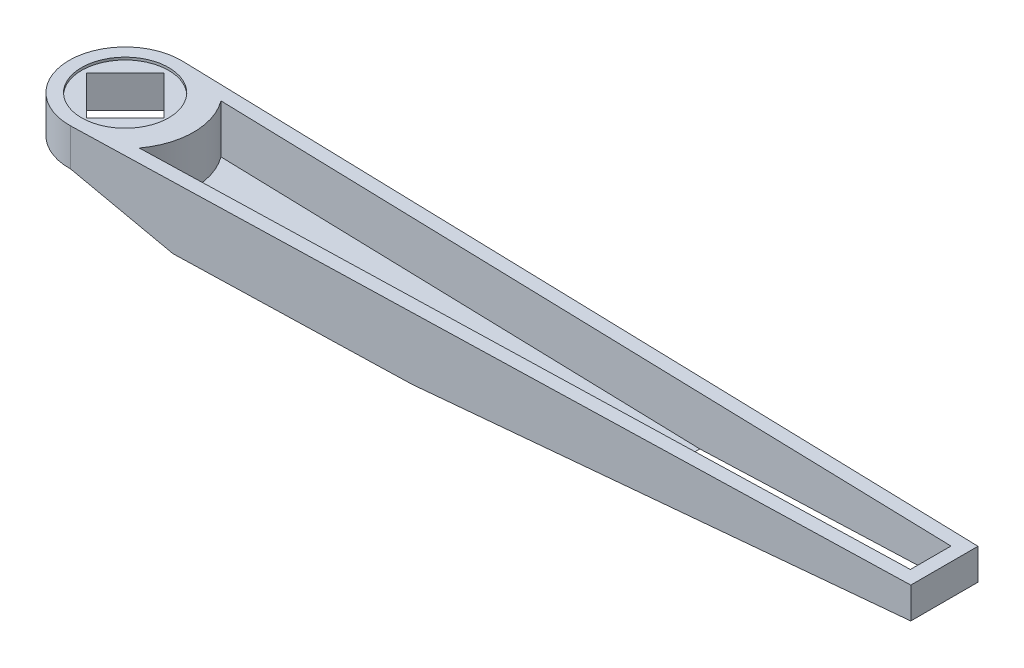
SolidWorks part; units mm, degrees
ref_plane "XY" through (0, 0, 0) normal (0, 0, 1) x (1, 0, 0)
ref_plane "XZ" through (0, 0, 0) normal (0, 1, 0) x (1, 0, 0)
ref_plane "YZ" through (0, 0, 0) normal (1, 0, 0) x (0, 0, -1)
sketch "A" plane through (0, 0, 0) normal (0, 1, 0) x (1, 0, 0)
  line L0 (0, 0) -> (329, 0) construction
  line L1 (0.6158, 22.4916) -> (329, 13.5)
  line L2 (329, 13.5) -> (329, -13.5)
  line L3 (0.6158, -22.4916) -> (329, -13.5)
  line L4 (0.6158, 22.4916) -> (0.6158, -22.4916)
  circle A0 centre (0, 0) radius 22.5
  dimension "D1" = 45
  dimension "D2" = 27
  dimension "D3" = 329
extrude "X1" add sketch "A" along normal blind 25 contours L0 A0 L3 L2 | A0 L0 L2 L1
sketch "B" plane through (0, 0, 0) normal (0, 0, 1) x (1, 0, 0)
  line L0 (329, 12.5) -> (134, 0)
  line L1 (329, 25) -> (329, 0) construction
  line L2 (0.6158, 0) -> (329, 0) construction
  line L3 (134, 0) -> (134, -74.1467)
  line L4 (134, -74.1467) -> (362.4662, -74.1467)
  line L5 (362.4662, -74.1467) -> (356.9119, 12.5)
  line L6 (356.9119, 12.5) -> (329, 12.5)
  dimension "D1" = 195
extrude "X2" cut sketch "B" against normal through all and the other way through all
sketch "Sketch3" plane through (0.6158, 0, 22.4916) normal (0.0274, 0, 0.9996) x (0.9996, 0, -0.0274)
  line L0 (0, 10) -> (40, 0)
  line L1 (0, 0) -> (133.4341, 0) construction
  line L2 (0, 25) -> (0, 0) construction
  dimension "D1" = 10
  dimension "D2" = 40
extrude "Cut-Extrude2" cut sketch "Sketch3" against normal through all and the other way through all flip side to cut
sketch "C" plane through (0, 25, 0) normal (0, 1, 0) x (1, 0, 0)
  circle A0 centre (0, 0) radius 22.5 construction
  circle A1 centre (0, 0) radius 22.5
extrude "X3" add sketch "C" against normal blind 15
sketch "Sketch2" plane through (0.6158, 0, 22.4916) normal (0.0274, 0, 0.9996) x (0.9996, 0, -0.0274)
  line L0 (0, 10) -> (40, 0)
  line L1 (40, 0) -> (133.4341, 0) construction
  dimension "D1" = 10
  dimension "D2" = 40
shell "S1" [suppressed] thickness 5.5
sketch "D" plane through (0, 10, 0) normal (0, -1, 0) x (-1, 0, 0)
  circle A0 centre (0, 0) radius 17.5
  dimension "D1" = 35
extrude "X5" [suppressed] cut sketch "D" against normal blind 1
sketch "E" plane through (0, 0, 0) normal (0, -1, 0) x (1, 0, 0)
  circle A1 centre (0, 0) radius 17.5
  dimension "D1" = 35
extrude "X6" [suppressed] cut sketch "E" against normal blind 1
sketch "F" [suppressed] plane through (0, 1, 0) normal (0, 1, 0) x (1, 0, 0)
  line L1 (0, 15.5563) -> (-15.5563, 0)
  line L2 (0, 15.5563) -> (15.5563, 0)
  line L3 (15.5563, 0) -> (0, -15.5563)
  line L4 (-15.5563, 0) -> (0, -15.5563)
  line L5 (0, 15.5563) -> (0, -15.5563) construction
  line L6 (15.5563, 0) -> (-15.5563, 0) construction
  point P0 (0, 0)
  dimension "D1" = 22
  dimension "D2" = 22
sketch "Sketch4" plane through (0, 25, 0) normal (0, 1, 0) x (1, 0, 0)
  circle A0 centre (0, 0) radius 17.5
  arc A1 (0.6158, 22.4916) -> (0.6158, -22.4916) centre (0, 0) ccw construction
  dimension "D1" = 35
fillet "F1" [suppressed] radius 4
extrude "Cut-Extrude3" cut sketch "Sketch4" against normal blind 1
extrude "X7" [suppressed] cut sketch "F" along normal through all
sketch "Sketch6" plane through (0, 25, 0) normal (0, 1, 0) x (1, 0, 0)
  line L0 (0.6158, 22.4916) -> (329, 13.5) construction
  line L1 (329, 13.5) -> (329, -13.5) construction
  line L2 (0.6158, -22.4916) -> (329, -13.5) construction
  line L3 (0.6158, 22.4916) -> (0.6158, -22.4916) construction
  line L4 (0.6158, 22.4916) -> (329, 13.5) construction
  line L5 (329, 13.5) -> (329, -13.5) construction
  line L6 (0.6158, -22.4916) -> (329, -13.5) construction
  line L7 (0.6158, 22.4916) -> (0.6158, -22.4916) construction
  line L8 (0, 15.5563) -> (-15.5563, 0)
  line L9 (-15.5563, 0) -> (0, -15.5563)
  line L10 (0, -15.5563) -> (15.5563, 0)
  line L11 (15.5563, 0) -> (0, 15.5563)
  line L12 (0, 15.5563) -> (0, -15.5563) construction
  line L13 (-15.5563, 0) -> (15.5563, 0) construction
  circle A0 centre (0, 0) radius 22.5 construction
  circle A1 centre (0, 0) radius 22.5 construction
  dimension "D1" = 22
extrude "Cut-Extrude4" cut sketch "Sketch6" against normal through all
sketch "Sketch7" plane through (0, 10, 0) normal (0, -1, 0) x (1, 0, 0)
  circle A0 centre (0, 0) radius 17.5
  arc A1 (0.6158, 22.4916) -> (0.6158, -22.4916) centre (0, 0) ccw construction
  dimension "D1" = 35
extrude "Cut-Extrude5" cut sketch "Sketch7" against normal blind 1
sketch "Sketch8" plane through (0, 25, 0) normal (0, 1, 0) x (1, 0, 0)
  circle A0 centre (0, 0) radius 22.5 construction
  circle A1 centre (0, 0) radius 22.5
sketch "Sketch10" plane through (0, 25, 0) normal (0, 1, 0) x (1, 0, 0)
  line L2 (0.4653, 16.9936) -> (328.8495, 8.0021)
  line L3 (22.0732, 16.402) -> (323.5, 8.1485)
  line L5 (0.4653, -16.9936) -> (328.8495, -8.0021)
  line L6 (22.0732, -16.402) -> (323.5, -8.1485)
  line L8 (323.5, 13.5) -> (323.5, -13.5)
  line L9 (323.5, 8.1485) -> (323.5, -8.1485)
  circle A2 centre (0, 0) radius 27.5
  arc A3 (22.0732, -16.402) -> (22.0732, 16.402) centre (0, 0) ccw
  dimension "D1" = 5
  dimension "D2" = 5.5
  dimension "D3" = 5.5
  dimension "D4" = 5.5
extrude "Cut-Extrude7" cut sketch "Sketch10" along direction (0, 1, 0) on the side against the normal offset from surface (19.5 mm away) 5.5
